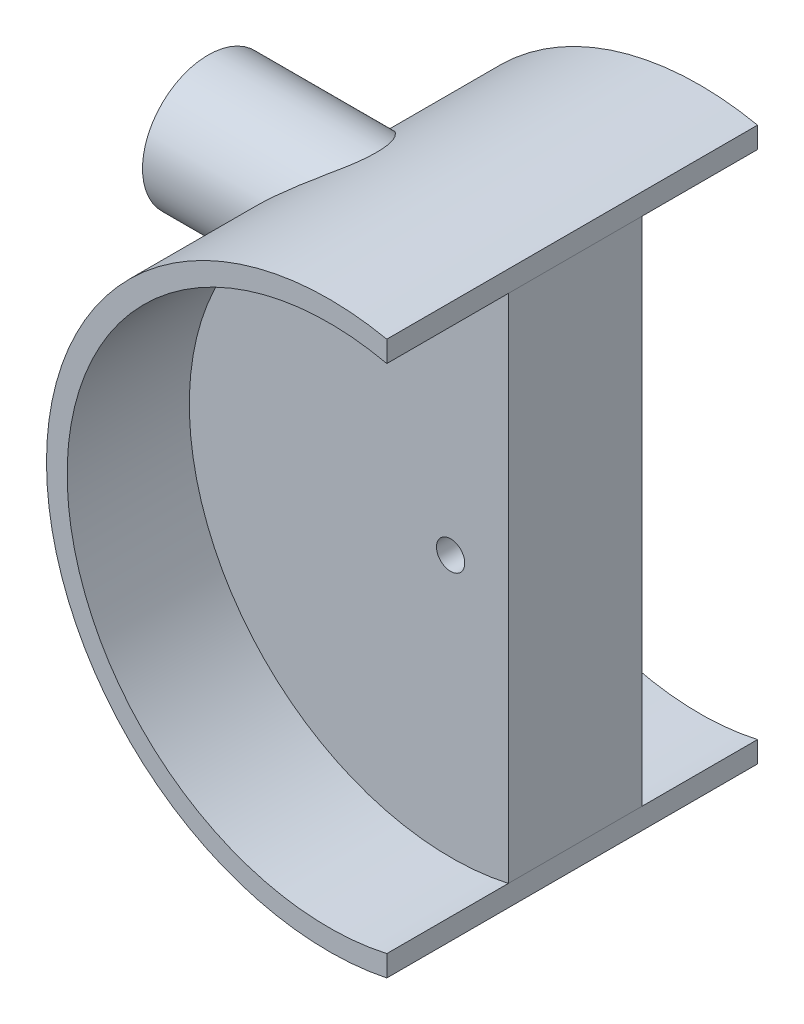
SolidWorks part; units mm, degrees
ref_plane "Front Plane" through (0, 0, 0) normal (0, 0, 1) x (1, 0, 0)
ref_plane "Top Plane" through (0, 0, 0) normal (0, 1, 0) x (1, 0, 0)
ref_plane "Right Plane" through (0, 0, 0) normal (1, 0, 0) x (0, 0, -1)
sketch "Sketch1" plane through (0, 0, 0) normal (0, 0, 1) x (1, 0, 0)
  line L0 (6.0325, 28.9047) -> (6.0325, 26.6954)
  line L1 (0, 0) -> (-29.5275, 0)
  line L2 (6.0325, -26.6954) -> (6.0325, -28.9047)
  arc A0 (6.0325, 28.9047) -> (6.0325, -28.9047) centre (0, 0) ccw
  arc A1 (6.0325, 26.6954) -> (6.0325, -26.6954) centre (0, 0) ccw
  circle A3 centre (0, 0) radius 29.5275 construction
  circle A4 centre (0, 0) radius 27.3685 construction
  point P1 (27.3685, 0)
  point P7 (28.2373, 8.633)
  dimension "D1" = 59.055
  dimension "D3" = 35.56
  dimension "D2" = 2.159
extrude "Boss-Extrude1" add sketch "Sketch1" along normal blind 38.735 contours A0 L2 A1 L0
sketch3d "3DSketch1"
  line L0 (6.0325, -26.6954, 38.735) -> (6.0325, -26.6954, 0) construction
  line L1 (6.0325, 26.6954, 26.035) -> (6.0325, -26.6954, 26.035)
  arc A0 (6.0325, 26.6954, 26.035) -> (6.0325, -26.6954, 26.035) centre (0.054, 0, 26.035) cw
  point P2 (0.054, 0, 53.3916)
  dimension "D1" = 12.7
extrude "Boss-Extrude2" add sketch "3DSketch1" along direction (0, 0, -1) on the side of the normal blind 13.97 separate body
sketch "Sketch2" plane through (0, 0, 26.035) normal (0, 0, 1) x (1, 0, 0)
  circle A0 centre (0, 0) radius 1.4762
extrude "Cut-Extrude1" cut sketch "Sketch2" against normal through all
sketch "Sketch4" plane through (6.0325, 0, 0) normal (1, 0, 0) x (0, 0, -1)
  line L0 (-38.735, 28.9047) -> (0, 28.9047) construction
  line L1 (-12.065, -26.6954) -> (-12.065, 26.6954) construction
  circle A0 centre (-19.05, 18.7447) radius 6.858
  dimension "D2" = 13.716
  dimension "D1" = 10.16
  dimension "D3" = 6.985
extrude "Boss-Extrude7" add sketch "Sketch4" against normal blind 38.354 separate body
sketch "Sketch6" plane through (-32.3215, 0, 0) normal (-1, 0, 0) x (0, 0, 1)
  circle A0 centre (19.05, 18.7447) radius 3.4925
  dimension "D1" = 6.985
extrude "Cut-Extrude2" cut sketch "Sketch6" against normal blind 19.304
